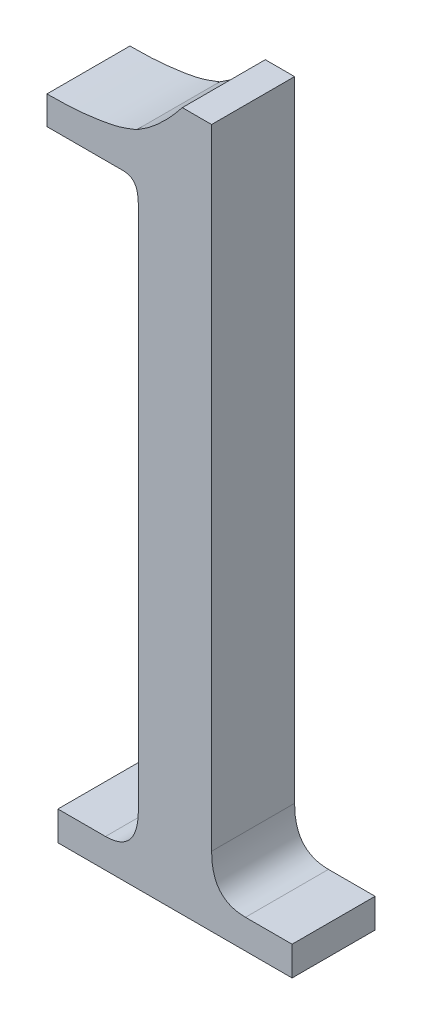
SolidWorks part; units mm, degrees
ref_plane "前基準面" through (0, 0, 0) normal (0, 0, 1) x (1, 0, 0)
ref_plane "上基準面" through (0, 0, 0) normal (0, 1, 0) x (1, 0, 0)
ref_plane "右基準面" through (0, 0, 0) normal (1, 0, 0) x (0, 0, -1)
sketch "草圖1" plane through (0, 0, 0) normal (0, 0, 1) x (1, 0, 0)
  text T0 "1" font "標楷體" height 25
extrude "填料-伸長1" add sketch "草圖1" along normal blind 3
